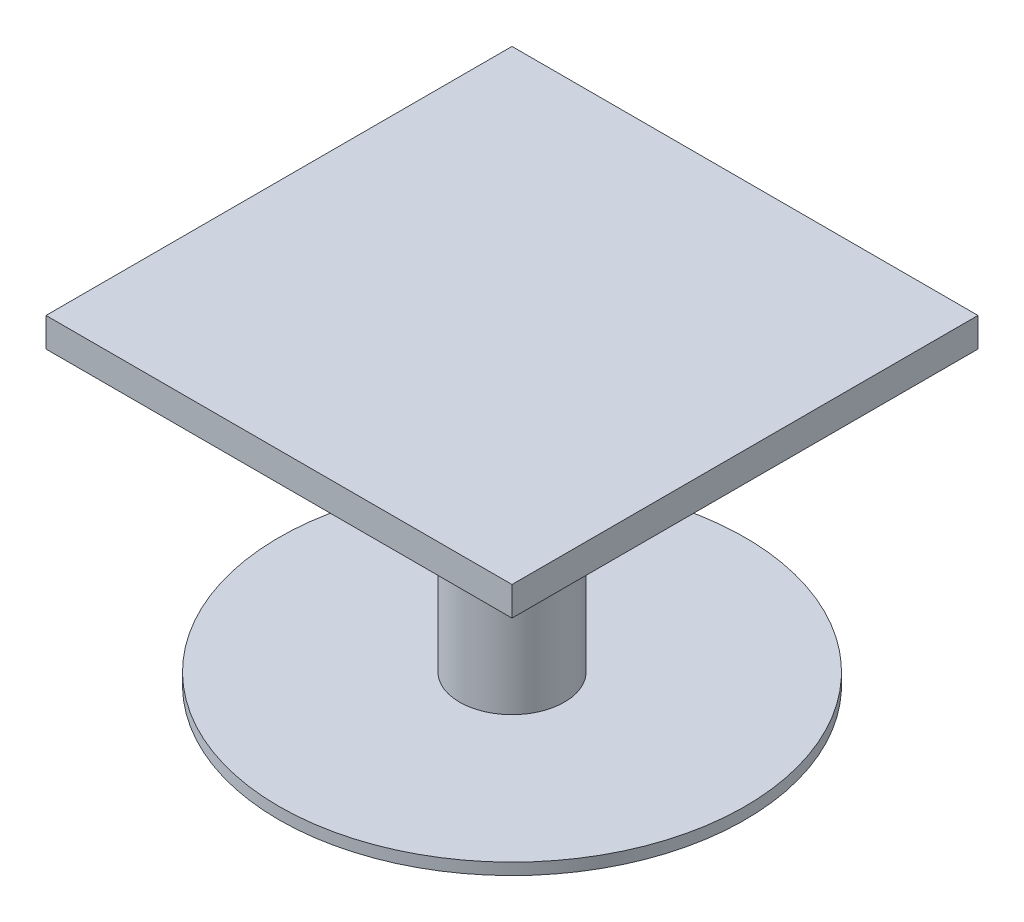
SolidWorks part; units mm, degrees
ref_plane "Plan de face" through (0, 0, 0) normal (0, 0, 1) x (1, 0, 0)
ref_plane "Plan de dessus" through (0, 0, 0) normal (0, 1, 0) x (1, 0, 0)
ref_plane "Plan de droite" through (0, 0, 0) normal (1, 0, 0) x (0, 0, -1)
sketch "Esquisse1" plane through (0, 0, 0) normal (0, 0, 1) x (1, 0, 0)
  line L0 (0, -16) -> (0, -20)
  line L1 (13.8564, 8) -> (17.3205, 10)
  line L2 (0, 21.4112) -> (0, -23.3838) construction
  arc A0 (0, -16) -> (13.8564, 8) centre (0, 0) ccw
  arc A1 (0, -20) -> (17.3205, 10) centre (0, 0) ccw
  dimension "D1" = 120
  dimension "D2" = 20
ref_plane "Plan1" through (0, -70, 0) normal (0, 1, 0) x (-1, 0, 0)
sketch "Esquisse2" plane through (0, -70, 0) normal (0, 1, 0) x (-1, 0, 0)
  circle A0 centre (0, 0) radius 40
extrude "Boss.-Extru.2" add sketch "Esquisse2" along normal blind 2 separate body
sketch "Esquisse3" plane through (0, -68, 0) normal (0, 1, 0) x (1, 0, 0)
  circle A0 centre (0, 0) radius 9
ref_plane "Plan2" through (0, -20, 0) normal (0, 1, 0) x (-1, 0, 0)
sketch "Esquisse4" plane through (0, -20, 0) normal (0, 1, 0) x (-1, 0, 0)
  line L1 (-40, 40) -> (40, 40)
  line L2 (-40, 40) -> (-40, -40)
  line L3 (-40, -40) -> (40, -40)
  line L4 (40, 40) -> (40, -40)
extrude "Boss.-Extru.3" add sketch "Esquisse4" along normal blind 5 separate body
extrude "Boss.-Extru.4" add sketch "Esquisse3" along normal up to surface (48 mm away)
sketch "Esquisse5" plane through (0, 0, 0) normal (0, 0, 1) x (1, 0, 0)
  line L0 (0, 12.436) -> (0, -45.3371)
  line L1 (0, 21.4112) -> (0, -23.3838) construction
